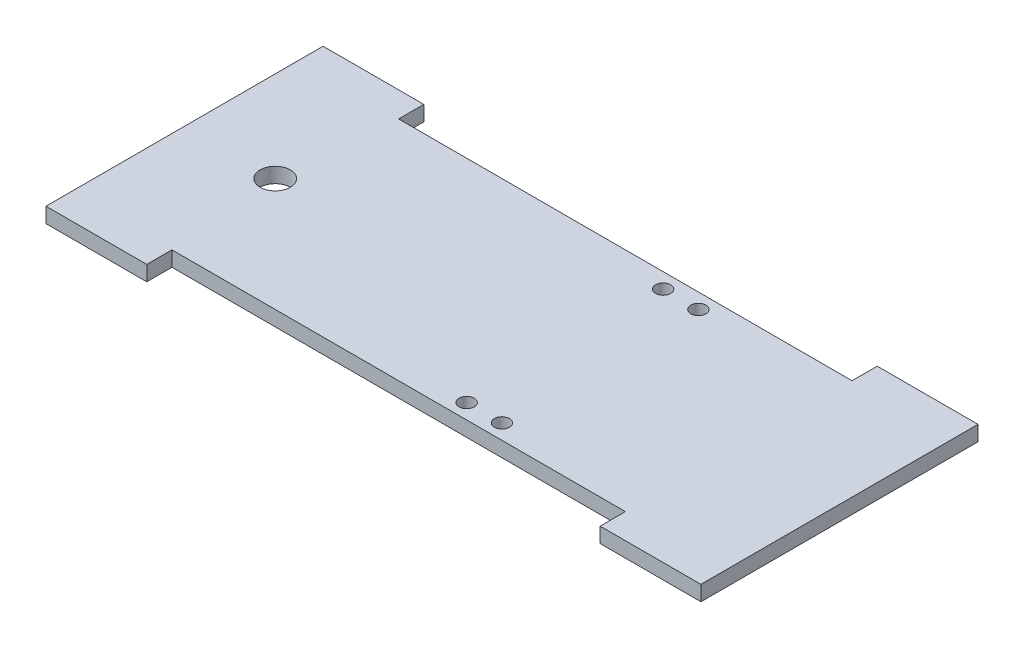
SolidWorks part; units mm, degrees
ref_plane "Plan de face" through (0, 0, 0) normal (0, 0, 1) x (1, 0, 0)
ref_plane "Plan de dessus" through (0, 0, 0) normal (0, 1, 0) x (1, 0, 0)
ref_plane "Plan de droite" through (0, 0, 0) normal (1, 0, 0) x (0, 0, -1)
sketch "Esquisse1" plane through (0, 0, 0) normal (0, 0, 1) x (1, 0, 0)
  line L1 (-86.0939, 3.421) -> (43.9061, 3.421)
  line L2 (-86.0939, 3.421) -> (-86.0939, 0.421)
  line L3 (-86.0939, 0.421) -> (43.9061, 0.421)
  line L4 (43.9061, 3.421) -> (43.9061, 0.421)
  dimension "D1" = 130
  dimension "D2" = 3
extrude "Extrusion1" add sketch "Esquisse1" along normal blind 55
sketch "Esquisse2" plane through (0, 3.421, 0) normal (0, 1, 0) x (-1, 0, 0)
  line L0 (86.0939, 55) -> (86.0939, 0) construction
  line L1 (66.0939, -6.1573) -> (-23.9061, -6.1573)
  line L2 (66.0939, -6.1573) -> (66.0939, 5)
  line L3 (66.0939, 5) -> (-23.9061, 5)
  line L4 (-23.9061, -6.1573) -> (-23.9061, 5)
  line L5 (-43.9061, 0) -> (86.0939, 0) construction
  line L6 (-43.9061, 55) -> (86.0939, 55) construction
  line L7 (66.0939, 50) -> (-23.9061, 50)
  line L8 (66.0939, 50) -> (66.0939, 71.8996)
  line L9 (66.0939, 71.8996) -> (-23.9061, 71.8996)
  line L10 (-23.9061, 50) -> (-23.9061, 71.8996)
  dimension "D1" = 20
  dimension "D2" = 5
  dimension "D3" = 90
  dimension "D4" = 5
extrude "Enlèv. mat.-Extru.1" cut sketch "Esquisse2" against normal blind 10
sketch "Esquisse3" plane through (0, 3.421, 0) normal (0, 1, 0) x (-1, 0, 0)
  line L1 (86.0939, 55) -> (86.0939, 0) construction
  line L19 (66.0939, 5) -> (-23.9061, 5) construction
  circle A0 centre (68.0939, 27.5) radius 3
  dimension "D1" = 6
  dimension "D2" = 15
  dimension "D3" = 22.5
extrude "Enlèv. mat.-Extru.2" cut sketch "Esquisse3" against normal through all
sketch "Esquisse4" plane through (0, 3.421, 0) normal (0, 1, 0) x (-1, 0, 0)
  line L0 (-43.9061, 55) -> (-43.9061, 0) construction
  line L1 (66.0939, 5) -> (-23.9061, 5) construction
  line L17 (-23.9061, 50) -> (66.0939, 50) construction
  circle A0 centre (3.5939, 8) radius 1.5
  circle A1 centre (3.5939, 47) radius 1.5
  dimension "D1" = 3
  dimension "D2" = 3
  dimension "D6" = 3
  dimension "D3" = 47.5
  dimension "D4" = 47.5
  dimension "D5" = 3
extrude "Enlèv. mat.-Extru.3" cut sketch "Esquisse4" against normal through all
pattern_linear "Répétition linéaire1" count 2 spacing 7 along (-1, 0, 0) of "Enlèv. mat.-Extru.3"
